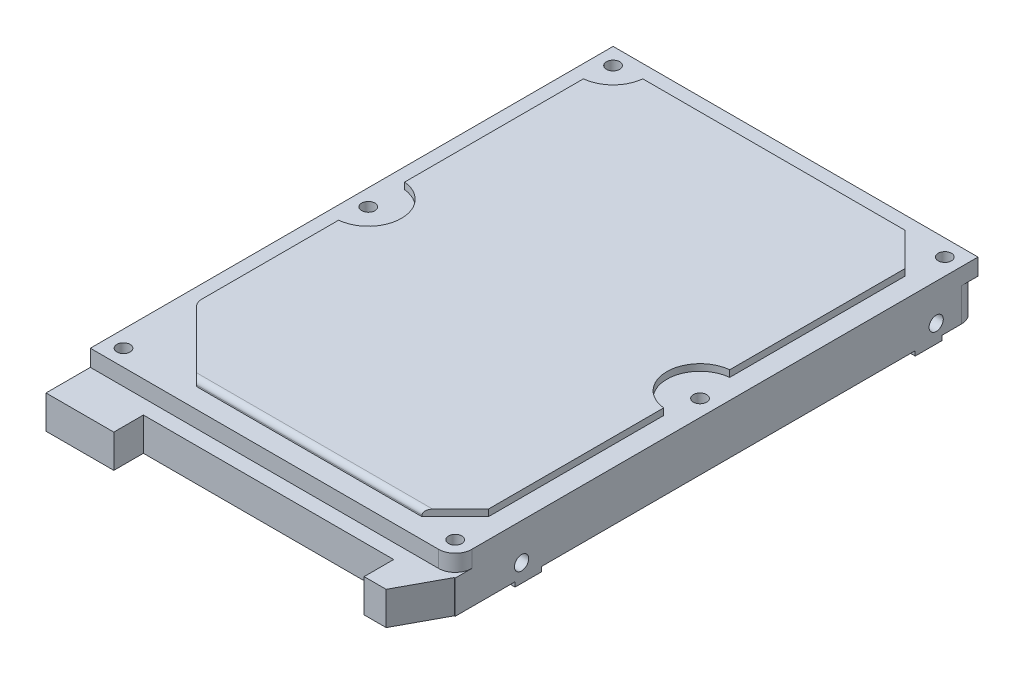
SolidWorks part; units mm, degrees
ref_plane "Front Plane" through (0, 0, 0) normal (0, 0, 1) x (1, 0, 0)
ref_plane "Top Plane" through (0, 0, 0) normal (0, 1, 0) x (1, 0, 0)
ref_plane "Right Plane" through (0, 0, 0) normal (1, 0, 0) x (0, 0, -1)
ref_plane "Plane1" through (0, 0, 0) normal (0, 1, 0) x (1, 0, 0)
sketch "S2D0001" plane through (0, 0, 0) normal (0, 1, 0) x (1, 0, 0)
  line L0 (0, 0) -> (69.85, 0)
  line L1 (69.85, 0) -> (69.85, 100.076)
  line L2 (69.85, 100.076) -> (0, 100.076)
  line L3 (0, 100.076) -> (0, 0)
extrude "Boss-Extrude1" add sketch "S2D0001" against normal blind 3.175
fillet "Fillet1" radius 3.175 1 edges at (69.85, -1.5875, 0)
ref_plane "Plane2" through (0, 0, 0) normal (0, 1, 0) x (1, 0, 0)
sketch "S2D0002" plane through (0, 0, 0) normal (0, 1, 0) x (1, 0, 0)
  circle A0 centre (3.175, 96.901) radius 1.27
  circle A1 centre (66.675, 96.901) radius 1.27
  circle A2 centre (3.175, 50.038) radius 1.27
  circle A3 centre (66.675, 50.038) radius 1.27
  circle A4 centre (3.175, 3.175) radius 1.27
  circle A5 centre (66.675, 3.175) radius 1.27
  dimension "D1" = 2.54
extrude "Cut-Extrude1" cut sketch "S2D0002" against normal blind 3.4925
sketch "Sketch3" plane through (0, 0, 0) normal (0, 1, 0) x (-1, 0, 0)
  line L0 (-9.4932, -96.266) -> (-59.69, -96.266)
  line L1 (-66.04, -89.916) -> (-66.04, -56.3562)
  line L2 (-66.04, -43.7198) -> (-66.04, -10.16)
  line L3 (-59.69, -3.81) -> (-16.51, -3.81)
  line L4 (-3.81, -16.51) -> (-3.81, -43.7198)
  line L5 (-3.81, -56.3562) -> (-3.81, -90.5828)
  line L6 (-3.81, -16.51) -> (-16.51, -3.81)
  line L7 (-66.04, -10.16) -> (-59.69, -3.81)
  line L8 (-59.69, -96.266) -> (-66.04, -89.916)
  arc A0 (-66.04, -56.3562) -> (-66.04, -43.7198) centre (-66.675, -50.038) ccw
  arc A1 (-3.81, -90.5828) -> (-9.4932, -96.266) centre (-3.175, -96.901) ccw
  arc A2 (-3.81, -43.7198) -> (-3.81, -56.3562) centre (-3.175, -50.038) ccw
  dimension "D1" = 6.35
extrude "Boss-Extrude2" add sketch "Sketch3" along normal blind 1.27
fillet "Fillet2" radius 2.54 1 edges at (3.81, 0.635, -16.51)
fillet "Fillet3" radius 1.016 1 edges at (38.1, 1.27, -3.81)
sketch "Sketch4" plane through (0, -3.175, 0) normal (0, -1, 0) x (1, 0, 0)
  line L0 (0, -96.901) -> (0, 0)
  line L1 (66.675, -100.076) -> (3.175, -100.076)
  line L2 (69.85, 0) -> (69.85, -96.901)
  line L3 (0, 0) -> (69.85, 0)
  arc A0 (0, -96.901) -> (3.175, -100.076) centre (3.175, -96.901) ccw
  arc A1 (66.675, -100.076) -> (69.85, -96.901) centre (66.675, -96.901) ccw
extrude "Boss-Extrude3" add sketch "Sketch4" along normal blind 6.35
ref_plane "Plane3" through (0, 0, 0) normal (1, 0, 0) x (0, 0, -1)
sketch "S2D0005" plane through (0, 0, 0) normal (1, 0, 0) x (0, 0, -1)
  line L0 (10.16, -3.175) -> (15.24, -3.175)
  line L1 (15.24, -3.175) -> (15.24, -9.525)
  line L2 (15.24, -9.525) -> (10.16, -9.525)
  line L3 (10.16, -9.525) -> (10.16, -3.175)
  line L4 (89.535, -3.175) -> (94.615, -3.175)
  line L5 (94.615, -3.175) -> (94.615, -9.525)
  line L6 (94.615, -9.525) -> (89.535, -9.525)
  line L7 (89.535, -9.525) -> (89.535, -3.175)
  point P8 (12.7, -9.525)
  point P9 (92.075, -9.525)
  point P10 (12.7, -6.985)
  point P11 (92.075, -6.985)
extrude "Boss-Extrude4" add sketch "S2D0005" along normal up to surface (69.85 mm away)
ref_plane "Plane4" through (12.7, -5.6261, -92.075) normal (0, 0, 1) x (0, 1, 0)
sketch "S2D0007" plane through (12.7, -5.6261, -92.075) normal (0, 0, 1) x (0, 1, 0)
  line L0 (-1.3589, -0.8165) -> (0, 0)
  line L1 (-1.3589, -0.8165) -> (-2.7178, 0)
  line L2 (0, 0) -> (0, 12.7)
  line L3 (-2.7178, 0) -> (-2.7178, 12.7)
  line L4 (0, 12.7) -> (-1.3589, 12.7)
  line L5 (-2.7178, 12.7) -> (-1.3589, 12.7)
  line L6 (-1.3589, -1.4923) -> (-1.3589, 13.3758) construction
revolve "Cut-Revolve1" cut sketch "S2D0007" angle 360 about L6
ref_plane "Plane5" through (12.7, -5.6261, -12.7) normal (0, 0, 1) x (0, 1, 0)
sketch "Sketch7" plane through (12.7, -5.6261, -12.7) normal (0, 0, 1) x (0, 1, 0)
  line L0 (-1.3589, -0.8165) -> (0, 0)
  line L1 (-1.3589, -0.8165) -> (-2.7178, 0)
  line L2 (0, 0) -> (0, 12.7)
  line L3 (-2.7178, 0) -> (-2.7178, 12.7)
  line L4 (0, 12.7) -> (-1.3589, 12.7)
  line L5 (-2.7178, 12.7) -> (-1.3589, 12.7)
  line L6 (-1.3589, -1.4923) -> (-1.3589, 13.3758) construction
revolve "Cut-Revolve2" cut sketch "Sketch7" angle 360 about L6
ref_plane "Plane6" through (57.15, -8.3439, -12.7) normal (0, 0, 1) x (0, -1, 0)
sketch "S2D0008" plane through (57.15, -8.3439, -12.7) normal (0, 0, 1) x (0, -1, 0)
  line L0 (-1.3589, -0.8165) -> (0, 0)
  line L1 (-1.3589, -0.8165) -> (-2.7178, 0)
  line L2 (0, 0) -> (0, 12.7)
  line L3 (-2.7178, 0) -> (-2.7178, 12.7)
  line L4 (0, 12.7) -> (-1.3589, 12.7)
  line L5 (-2.7178, 12.7) -> (-1.3589, 12.7)
  line L6 (-1.3589, -1.4923) -> (-1.3589, 13.3758) construction
revolve "Cut-Revolve3" cut sketch "S2D0008" angle 360 about L6
ref_plane "Plane7" through (57.15, -8.3439, -92.075) normal (0, 0, 1) x (0, -1, 0)
sketch "S2D0009" plane through (57.15, -8.3439, -92.075) normal (0, 0, 1) x (0, -1, 0)
  line L0 (-1.3589, -0.8165) -> (0, 0)
  line L1 (-1.3589, -0.8165) -> (-2.7178, 0)
  line L2 (0, 0) -> (0, 12.7)
  line L3 (-2.7178, 0) -> (-2.7178, 12.7)
  line L4 (0, 12.7) -> (-1.3589, 12.7)
  line L5 (-2.7178, 12.7) -> (-1.3589, 12.7)
  line L6 (-1.3589, -1.4923) -> (-1.3589, 13.3758) construction
revolve "Cut-Revolve4" cut sketch "S2D0009" angle 360 about L6
sketch "Sketch10" plane through (0, -9.525, 0) normal (0, -1, 0) x (1, 0, 0)
  line L0 (0, -93.14) -> (0, -88.06)
  line L1 (0, -88.06) -> (4.065, -88.06)
  line L2 (4.065, -93.14) -> (0, -93.14)
  line L3 (0, -16.54) -> (0, -11.46)
  line L4 (0, -11.46) -> (4.065, -11.46)
  line L5 (4.065, -16.54) -> (0, -16.54)
  line L6 (69.85, -11.46) -> (69.85, -16.54)
  line L7 (69.85, -16.54) -> (65.785, -16.54)
  line L8 (65.785, -11.46) -> (69.85, -11.46)
  line L9 (69.85, -88.06) -> (69.85, -93.14)
  line L10 (69.85, -93.14) -> (65.785, -93.14)
  line L11 (65.785, -88.06) -> (69.85, -88.06)
  line L12 (34.925, -100.076) -> (34.925, -43.4821) construction
  line L13 (3.175, -100.076) -> (66.675, -100.076) construction
  line L14 (69.85, -96.901) -> (69.85, 0) construction
  line L15 (69.85, 0) -> (0, 0) construction
  line L16 (65.785, -14) -> (4.065, -14) construction
  line L17 (65.785, -90.6) -> (65.785, -14) construction
  line L18 (4.065, -90.6) -> (4.065, -14) construction
  line L19 (0, 0) -> (0, -96.901) construction
  arc A0 (65.785, -11.46) -> (65.785, -16.54) centre (65.785, -14) ccw
  arc A1 (4.065, -16.54) -> (4.065, -11.46) centre (4.065, -14) ccw
  arc A2 (4.065, -93.14) -> (4.065, -88.06) centre (4.065, -90.6) ccw
  arc A3 (65.785, -88.06) -> (65.785, -93.14) centre (65.785, -90.6) ccw
  point P20 (4.065, -90.6)
  point P21 (4.065, -14)
  point P22 (65.785, -14)
  point P23 (65.785, -90.6)
  dimension "D2" = 76.6
  dimension "D1" = 61.72
  dimension "D3" = 14
extrude "Boss-Extrude5" add sketch "Sketch10" along normal blind 0.889
ref_plane "Plane8" through (4.9911, -4.064, -92.075) normal (0, 0, 1) x (-1, 0, 0)
ref_plane "Plane9" through (62.1411, -4.064, -92.075) normal (0, 0, 1) x (-1, 0, 0)
ref_plane "Plane10" through (62.1411, -4.064, -12.7) normal (0, 0, 1) x (-1, 0, 0)
ref_plane "Plane11" through (4.9911, -4.064, -12.7) normal (0, 0, 1) x (-1, 0, 0)
sketch "Sketch15" plane through (0, -9.525, 0) normal (0, -1, 0) x (1, 0, 0)
  line L0 (69.6836, 0) -> (65.1116, 8.4836)
  line L1 (65.1116, 8.4836) -> (60.8952, 8.4836)
  line L2 (60.8952, 8.4836) -> (60.8952, 2.8194)
  line L3 (60.8952, 2.8194) -> (12.9794, 2.8194)
  line L4 (12.9794, 2.8194) -> (12.9794, 8.4836)
  line L5 (12.9794, 8.4836) -> (0, 8.4836)
  line L6 (0, 8.4836) -> (0, 0)
  line L7 (0, 0) -> (69.6836, 0)
  dimension "D1" = 5.6642
ref_plane "Plane12" through (0, -3.175, 0) normal (0, -1, 0) x (1, 0, 0)
extrude "Boss-Extrude6" add sketch "Sketch15" against normal up to surface (6.35 mm away)
sketch "Sketch16" plane through (0, -10.414, 0) normal (0, -1, 0) x (1, 0, 0)
  circle A0 centre (4.065, -14) radius 2
  circle A1 centre (65.785, -14) radius 2
  circle A2 centre (65.785, -90.6) radius 2
  circle A3 centre (4.065, -90.6) radius 2
  dimension "D1" = 4
extrude "Cut-Extrude2" cut sketch "Sketch16" against normal blind 2
